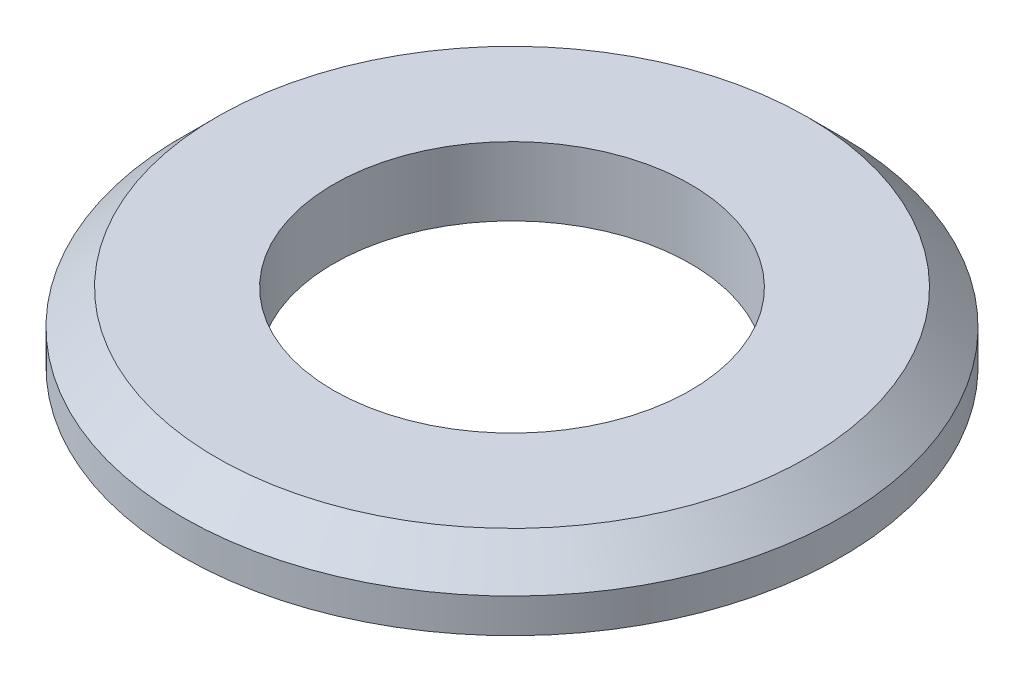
SolidWorks part; units mm, degrees
ref_plane "Front" through (0, 0, 0) normal (0, 0, 1) x (1, 0, 0)
ref_plane "Top" through (0, 0, 0) normal (0, 1, 0) x (1, 0, 0)
ref_plane "Right" through (0, 0, 0) normal (1, 0, 0) x (0, 0, -1)
sketch "Sketch1" plane through (0, 0, 0) normal (0, 1, 0) x (1, 0, 0)
  circle A0 centre (0, 0) radius 6.5
  circle A1 centre (0, 0) radius 12
extrude "Extrude1" add sketch "Sketch1" along normal blind 2.5
chamfer "Chamfer1" distance 1.25 1 edges at (0, 2.5, 12)
